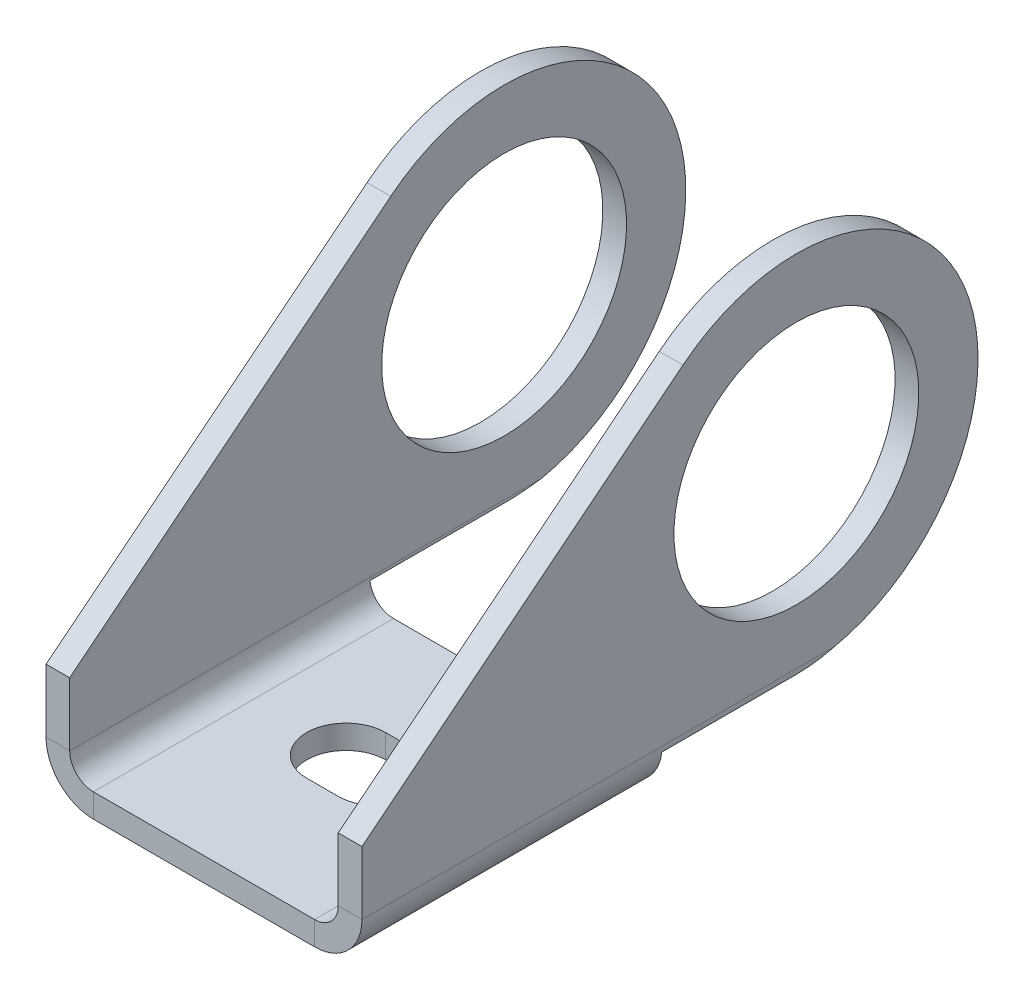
SolidWorks part; units mm, degrees
ref_plane "Plan1" through (0, 0, 0) normal (0, 0, 1) x (1, 0, 0)
ref_plane "Plan2" through (0, 0, 0) normal (0, 1, 0) x (1, 0, 0)
ref_plane "Plan3" through (0, 0, 0) normal (1, 0, 0) x (0, 0, -1)
sketch "Esquisse1" plane through (0, 0, 0) normal (0, 0, 1) x (1, 0, 0)
  line L0 (-18.5, 50) -> (-18.5, 0)
  line L1 (-18.5, 0) -> (18.5, 0)
  line L2 (18.5, 0) -> (18.5, 50)
  dimension "D1" = 37
  dimension "D2" = 50
extrude "Base-Extru.-Mince" add sketch "Esquisse1" along normal blind 78 thin
sheet metal parameters "Tôlerie 1" parameters "D1"=3
bend "Pli dans angle2" bend angle 90 parameters "D1"=0, "D5"=1
flatten bends "Dépliage 1" parameters "D1"=0
sketch "Esquisse-Angle1" plane through (0, -1.5, 0) normal (0, -1, 0) x (1, 0, 0)
  line L0 (17.5343, 78) -> (17.5343, 0) construction
  line L1 (-17.5343, 0) -> (-17.5343, 78) construction
bend "Pli dans angle1" bend angle 90 parameters "D1"=0, "D5"=2
sketch "Esquisse4" plane through (0, 1.5, 0) normal (0, 1, 0) x (-1, 0, 0)
  line L2 (-20.5686, 23) -> (-20.5686, 40)
  line L3 (-20.5686, 40) -> (20.5686, 40)
  line L4 (20.5686, 23) -> (20.5686, 40)
  line L7 (-21.0686, 78) -> (-21.0686, 0) construction
  line L9 (0, -7) -> (0, 48) construction
  line L10 (-2, 63) -> (2, 63)
  line L11 (-2, 53) -> (2, 53)
  line L12 (-29.0686, 78) -> (-61.5384, 37.3557)
  line L13 (-66.5686, 78) -> (-66.5686, 0) construction
  line L14 (-21.0686, 0) -> (-66.5686, 0) construction
  line L17 (-67.8519, -8.9076) -> (-67.8519, 78)
  line L18 (-67.8519, 78) -> (-29.0686, 78)
  line L20 (-21.0686, 78) -> (-66.5686, 78) construction
  line L21 (67.8519, 78) -> (29.0686, 78)
  line L22 (67.8519, -8.9076) -> (67.8519, 78)
  line L23 (-67.8519, -8.9076) -> (67.8519, -8.9076)
  line L25 (29.0686, 78) -> (61.5384, 37.3557)
  line L26 (14, 78) -> (-14, 78) construction
  arc A0 (-2, 63) -> (-2, 53) centre (-2, 58) ccw
  arc A1 (2, 63) -> (2, 53) centre (2, 58) cw
  arc A2 (-61.5384, 37.3557) -> (-20.5686, 23) centre (-43.5686, 23) ccw
  arc A3 (61.5384, 37.3557) -> (20.5686, 23) centre (43.5686, 23) cw
  circle A4 centre (-43.5686, 23) radius 15.5
  circle A5 centre (43.5686, 23) radius 15.5
  dimension "D3" = 5
  dimension "D6" = 46
  dimension "D7" = 31
  dimension "D1" = 38
  dimension "D2" = 8
  dimension "D4" = 4
  dimension "D5" = 20
extrude "Enlèv. mat.-Extru.1" cut sketch "Esquisse4" against normal through all
process bends "Pliage 1" parameters "D1"=0
sketch "Esquisse-Plate1" plane through (0, -1.5, 0) normal (0, -1, 0) x (1, 0, 0)
